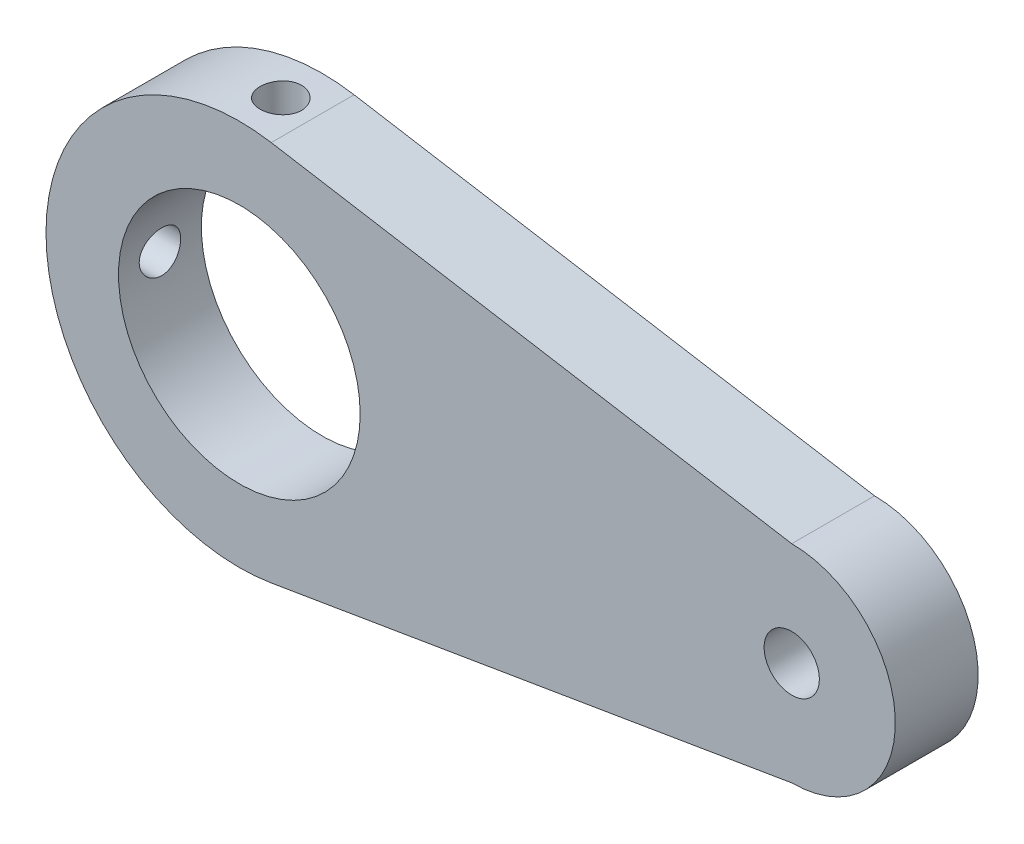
SolidWorks part; units mm, degrees
ref_plane "前视基准面" through (0, 0, 0) normal (0, 0, 1) x (1, 0, 0)
ref_plane "上视基准面" through (0, 0, 0) normal (0, 1, 0) x (1, 0, 0)
ref_plane "右视基准面" through (0, 0, 0) normal (1, 0, 0) x (0, 0, -1)
sketch "草图1" plane through (0, 0, 0) normal (0, 0, 1) x (1, 0, 0)
  line L0 (0, 0) -> (80, 0) construction
  line L1 (4.622, 27.6159) -> (80, 15)
  line L2 (4.622, -27.6159) -> (80, -15)
  circle A0 centre (0, 0) radius 17.5
  arc A1 (4.622, 27.6159) -> (4.622, -27.6159) centre (0, 0) ccw
  arc A2 (80, -15) -> (80, 15) centre (80, 0) ccw
  circle A3 centre (80, 0) radius 4
  dimension "D1" = 8
extrude "凸台-拉伸1" add sketch "草图1" along normal blind 12
ref_plane "基准面1" through (0, 28, 0) normal (0, 1, 0) x (1, 0, 0)
sketch "草图2" plane through (0, 28, 0) normal (0, 1, 0) x (1, 0, 0)
  line L0 (0, 0) -> (0, -12) construction
  circle A0 centre (0, -6) radius 3
extrude "切除-拉伸1" cut sketch "草图2" against normal blind 12
ref_plane "基准面2" through (-28, 0, 0) normal (1, 0, 0) x (0, 0, -1)
sketch "草图3" plane through (-28, 0, 0) normal (1, 0, 0) x (0, 0, -1)
  line L0 (0, 0) -> (-12, 0) construction
  circle A0 centre (-6, 0) radius 3
extrude "切除-拉伸2" cut sketch "草图3" along normal blind 16
